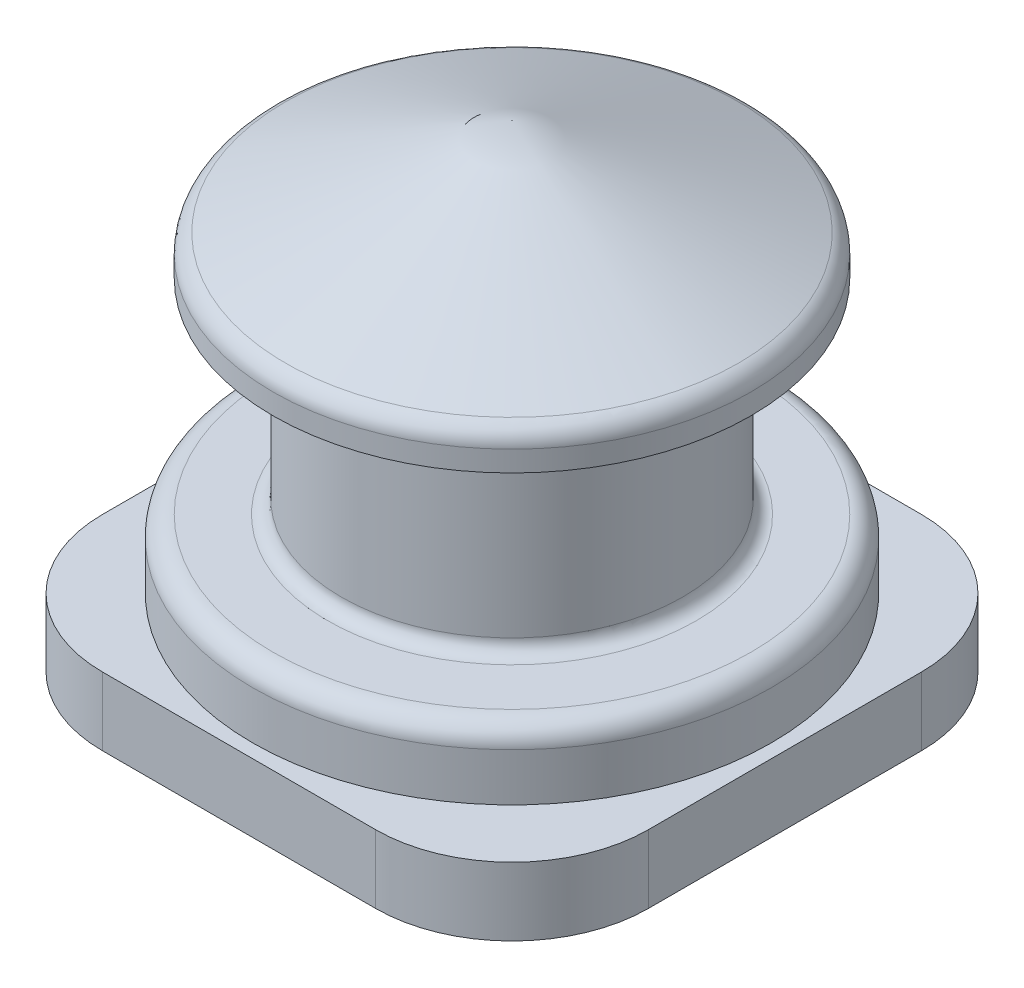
SolidWorks part; units mm, degrees
ref_plane "Plan de face" through (0, 0, 0) normal (0, 0, 1) x (1, 0, 0)
ref_plane "Plan de dessus" through (0, 0, 0) normal (0, 1, 0) x (1, 0, 0)
ref_plane "Plan de droite" through (0, 0, 0) normal (1, 0, 0) x (0, 0, -1)
sketch "Esquisse1" plane through (0, 0, 0) normal (0, 0, 1) x (1, 0, 0)
  line L0 (0, 0) -> (38, 0)
  line L1 (38, 0) -> (38, 10)
  line L2 (38, 10) -> (25, 10)
  line L3 (25, 10) -> (25, 40)
  line L4 (25, 40) -> (35, 40)
  line L5 (35, 40) -> (35, 45)
  line L6 (35, 45) -> (0, 60)
  line L7 (0, 60) -> (0, 0)
  dimension "D1" = 38
  dimension "D2" = 25
  dimension "D3" = 35
  dimension "D4" = 10
  dimension "D5" = 30
  dimension "D6" = 5
  dimension "D7" = 60
revolve "Révolution1" add sketch "Esquisse1" angle 360 about L7
sketch "Esquisse2" plane through (0, 0, 0) normal (0, -1, 0) x (1, 0, 0)
  line L1 (-40, -40) -> (40, -40)
  line L2 (-40, -40) -> (-40, 40)
  line L3 (-40, 40) -> (40, 40)
  line L4 (40, -40) -> (40, 40)
  line L5 (-40, -40) -> (40, 40) construction
  line L6 (-40, 40) -> (40, -40) construction
  point P0 (0, 0)
  dimension "D1" = 80
extrude "Boss.-Extru.1" add sketch "Esquisse2" along normal blind 10
fillet "Congé1" radius 20 4 edges at (40, -5, -40) (-40, -5, -40) (-40, -5, 40) (40, -5, 40)
fillet "Congé2" radius 2 2 edges at (-25, 40, 0) (-25, 10, 0)
fillet "Congé3" radius 3 2 edges at (-35, 45, 0) (-38, 10, 0)
hole_wizard "Trou taraudé M61" positions "Esquisse5" profile "Esquisse4" tap size "M6" standard "ISO"
sketch "Esquisse5" plane through (0, -10, 0) normal (0, -1, 0) x (-1, 0, 0)
  line L0 (0, 0) -> (48.5555, 0) construction
  line L2 (0, 0) -> (24.7487, 24.7487) construction
  point P8 (24.7487, 24.7487)
  dimension "D1" = 35
  dimension "D2" = 45
sketch "Esquisse4" plane through (-24.7487, -10, -24.7487) normal (1, 0, 0) x (0, 0, -1)
  line L0 (0, 0) -> (0, 18.5022)
  line L1 (0, 18.5022) -> (2.5, 17)
  line L2 (2.5, 17) -> (2.5, 0)
  line L5 (2.5, 0) -> (0, 0)
  line L10 (0, 18.5022) -> (-2.5, 17) construction
  line L11 (0, -6.35) -> (0, 107.95) construction
  dimension "Diamètre du trou pour taraudage" = 5
  dimension "Profondeur du trou pour taraudage" = 17
  dimension "Angle de pointe" = 118
pattern_circular "Répétition circulaire1" count 4 over 360 about axis through (0, 0, 0) along (0, 1, 0) of "Trou taraudé M61"
